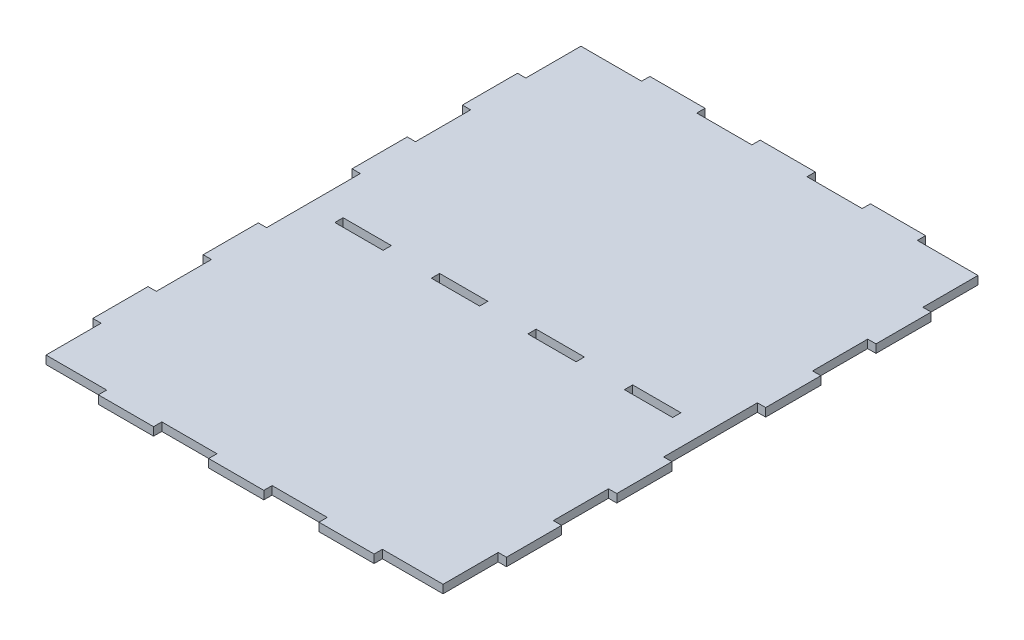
SolidWorks part; units mm, degrees
ref_plane "Alzado" through (0, 0, 0) normal (0, 0, 1) x (1, 0, 0)
ref_plane "Planta" through (0, 0, 0) normal (0, 1, 0) x (1, 0, 0)
ref_plane "Vista lateral" through (0, 0, 0) normal (1, 0, 0) x (0, 0, -1)
sketch "Sketch1" plane through (0, 0, 0) normal (0, 1, 0) x (1, 0, 0)
  line L1 (0, 0) -> (600, 0)
  line L2 (0, 0) -> (0, 800)
  line L3 (0, 800) -> (600, 800)
  line L4 (600, 0) -> (600, 800)
  dimension "D1" = 600
  dimension "D2" = 800
extrude "Boss-Extrude1" add sketch "Sketch1" along normal blind 12
sketch "Sketch2" plane through (0, 12, 0) normal (0, 1, 0) x (1, 0, 0)
  line L0 (588, 332) -> (588, 468)
  line L5 (0, 400) -> (600, 400) construction
  line L18 (0, 800) -> (0, 0) construction
  line L19 (600, 0) -> (600, 800) construction
  line L32 (0, 0) -> (600, 0) construction
  line L45 (0, 0) -> (100, 0)
  line L46 (0, 0) -> (0, 12)
  line L47 (12, 12) -> (100, 12)
  line L48 (100, 0) -> (100, 12)
  line L49 (180, 0) -> (260, 0)
  line L50 (180, 0) -> (180, 12)
  line L51 (180, 12) -> (260, 12)
  line L52 (260, 0) -> (260, 12)
  line L53 (600, 800) -> (600, 788)
  line L54 (340, 0) -> (420, 0)
  line L55 (340, 0) -> (340, 12)
  line L56 (340, 12) -> (420, 12)
  line L57 (420, 0) -> (420, 12)
  line L58 (500, 0) -> (600, 0)
  line L59 (500, 0) -> (500, 12)
  line L60 (500, 12) -> (588, 12)
  line L61 (600, 0) -> (600, 12)
  line L62 (500, 788) -> (588, 788)
  line L63 (500, 800) -> (500, 788)
  line L64 (500, 800) -> (600, 800)
  line L65 (420, 800) -> (420, 788)
  line L66 (340, 788) -> (420, 788)
  line L67 (340, 800) -> (340, 788)
  line L68 (340, 800) -> (420, 800)
  line L69 (260, 800) -> (260, 788)
  line L70 (180, 788) -> (260, 788)
  line L71 (180, 800) -> (180, 788)
  line L72 (180, 800) -> (260, 800)
  line L73 (100, 800) -> (100, 788)
  line L74 (12, 788) -> (100, 788)
  line L75 (0, 800) -> (0, 788)
  line L76 (0, 800) -> (100, 800)
  line L77 (300, 0) -> (300, 400) construction
  line L110 (600, 468) -> (588, 468)
  line L112 (0, 12) -> (0, 92)
  line L113 (0, 92) -> (12, 92)
  line L114 (12, 12) -> (12, 92)
  line L115 (0, 172) -> (12, 172)
  line L116 (0, 172) -> (0, 252)
  line L117 (0, 252) -> (12, 252)
  line L118 (12, 172) -> (12, 252)
  line L119 (0, 332) -> (12, 332)
  line L120 (0, 332) -> (0, 468)
  line L121 (0, 468) -> (12, 468)
  line L122 (12, 332) -> (12, 468)
  line L123 (600, 332) -> (600, 468)
  line L124 (600, 332) -> (588, 332)
  line L125 (588, 172) -> (588, 252)
  line L126 (600, 252) -> (588, 252)
  line L127 (600, 172) -> (600, 252)
  line L128 (600, 172) -> (588, 172)
  line L129 (600, 628) -> (588, 628)
  line L131 (600, 12) -> (600, 92)
  line L132 (600, 92) -> (588, 92)
  line L133 (588, 12) -> (588, 92)
  line L134 (600, 628) -> (600, 548)
  line L135 (600, 548) -> (588, 548)
  line L136 (588, 628) -> (588, 548)
  line L137 (12, 628) -> (12, 548)
  line L138 (0, 548) -> (12, 548)
  line L139 (0, 628) -> (0, 548)
  line L140 (0, 628) -> (12, 628)
  line L142 (0, 708) -> (12, 708)
  line L143 (0, 708) -> (0, 788)
  line L145 (12, 708) -> (12, 788)
  line L146 (600, 708) -> (588, 708)
  line L147 (600, 708) -> (600, 788)
  line L149 (588, 708) -> (588, 788)
extrude "Cut-Extrude1" cut sketch "Sketch2" against normal blind 12
sketch "Sketch3" plane through (0, 12, 0) normal (0, 1, 0) x (1, 0, 0)
  line L0 (12, 400) -> (588, 400) construction
  line L1 (0, 548) -> (0, 468) construction
  line L9 (12, 332) -> (12, 468) construction
  line L10 (588, 468) -> (588, 332) construction
  line L16 (55, 400) -> (125, 400)
  line L21 (55, 400) -> (55, 388)
  line L22 (55, 388) -> (125, 388)
  line L24 (125, 400) -> (125, 388)
  line L30 (195, 400) -> (265, 400)
  line L31 (195, 400) -> (195, 388)
  line L32 (195, 388) -> (265, 388)
  line L33 (265, 400) -> (265, 388)
  line L34 (335, 400) -> (405, 400)
  line L35 (335, 400) -> (335, 388)
  line L36 (335, 388) -> (405, 388)
  line L37 (405, 400) -> (405, 388)
  line L38 (475, 400) -> (545, 400)
  line L39 (475, 400) -> (475, 388)
  line L40 (475, 388) -> (545, 388)
  line L41 (545, 400) -> (545, 388)
extrude "Cut-Extrude2" cut sketch "Sketch3" against normal blind 12
equation "\"mat\"= 12mm"
equation "\"pes\"= 80mm"
equation "\"sep\"= 80mm"
equation "\"D1@Boss-Extrude1\"=\"mat\""
equation "\"D1@Cut-Extrude1\"=\"mat\""
equation "\"D4@Sketch2\"=\"pes\""
equation "\"D5@Sketch2\"=\"sep\""
equation "\"D6@Sketch2\"=\"pes\""
equation "\"D7@Sketch2\"=\"mat\""
equation "\"D8@Sketch2\"=\"mat\""
equation "\"D9@Sketch2\"=\"mat\""
equation "\"D11@Sketch2\"=\"sep\""
equation "\"D12@Sketch2\"=\"pes\""
equation "\"D13@Sketch2\"=\"mat\""
equation "\"D14@Sketch2\"=\"pes\""
equation "\"D15@Sketch2\"=\"mat\""
equation "\"D16@Sketch2\"=\"sep\""
equation "\"D17@Sketch2\"=\"mat\""
equation "\"D18@Sketch2\"=\"sep\""
equation "\"D19@Sketch2\"=136"
equation "\"D20@Sketch2\"=\"pes\""
equation "\"D21@Sketch2\"=\"mat\""
equation "\"D23@Sketch2\"=\"mat\""
equation "\"D24@Sketch2\"=\"sep\""
equation "\"D25@Sketch2\"=\"pes\""
equation "\"D26@Sketch2\"=\"sep\""
equation "\"D27@Sketch2\"=\"pes\""
equation "\"D22@Sketch2\"=\"mat\""
equation "\"D3@Sketch2\"=\"mat\""
equation "\"D28@Sketch2\"=100"
equation "\"D29@Sketch2\"=\"mat\""
equation "\"D30@Sketch2\"=\"sep\""
equation "\"D1@Cut-Extrude2\"=\"mat\""
equation "\"D5@Sketch3\"=\"mat\""
equation "\"D6@Sketch3\"=\"mat\""
